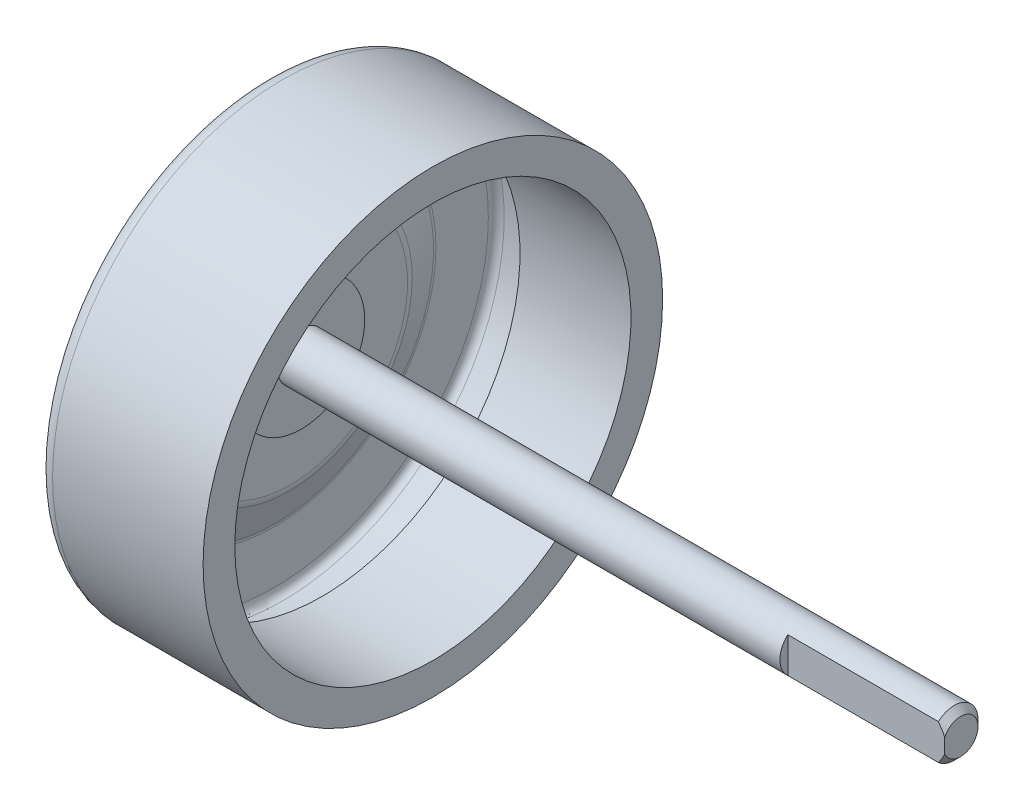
SolidWorks part; units mm, degrees
ref_plane "Plan de face" through (0, 0, 0) normal (0, 0, 1) x (1, 0, 0)
ref_plane "Plan de dessus" through (0, 0, 0) normal (0, 1, 0) x (1, 0, 0)
ref_plane "Plan de droite" through (0, 0, 0) normal (1, 0, 0) x (0, 0, -1)
sketch "Esquisse1" plane through (0, 0, 0) normal (0, 0, 1) x (1, 0, 0)
  line L0 (-6.4357, 0) -> (58.0712, 0) construction
  line L1 (0, 20) -> (0, -20) construction
  line L2 (10.5, 20) -> (10.5, -21.8881) construction
  line L3 (-2.6612, 14.5) -> (14.1549, 14.5) construction
  line L4 (2.2752, 12.5) -> (11.4427, 12.5) construction
  line L5 (3.5, 16.0838) -> (3.5, 10.7677) construction
  line L6 (-0.9253, 14) -> (3.9025, 14) construction
  line L7 (-1.7933, 10) -> (1.7869, 10) construction
  line L8 (0, 7.5) -> (2.2752, 7.5) construction
  line L9 (1, 8.164) -> (1, -0.5696) construction
  line L10 (10.5, 14.5) -> (1, 14.5)
  line L11 (0, 13.5) -> (0, 10.1926)
  line L12 (0.0715, 9.8212) -> (0.9642, 7.5894)
  line L13 (-0.9253, 4) -> (3.9025, 4) construction
  line L14 (0.8, 4.638) -> (0.8, -0.5696) construction
  line L15 (1, 4) -> (1, 7.4037)
  line L16 (1.5, 4) -> (1.5, 7.4037)
  line L17 (0.5358, 10.0069) -> (1.4285, 7.7751)
  line L18 (0.5, 13.5) -> (0.5, 10.1926)
  line L19 (3.5, 14) -> (1, 14)
  line L20 (10.5, 14) -> (0.5, 14) construction
  line L21 (3.5, 14) -> (3.5, 12.5)
  line L22 (3.5, 12.5) -> (10.5, 12.5)
  line L23 (10.5, 12.5) -> (10.5, 14.5)
  line L24 (2.2, 6.1272) -> (2.2, -1.0459) construction
  line L25 (43.8, 7.5) -> (43.8, -11.6094) construction
  line L26 (-1.7933, 1.5) -> (47.2832, 1.5) construction
  line L27 (1.5, 4) -> (2.2, 4)
  line L28 (2.2, 4) -> (2.2, 1.5)
  line L29 (2.2, 1.5) -> (43.8, 1.5)
  line L30 (43.8, 1.5) -> (43.8, 0)
  line L31 (43.8, 0) -> (0.8, 0)
  line L32 (0.8, 0) -> (0.8, 4)
  line L33 (0.8, 4) -> (1, 4)
  line L34 (10.5, 14.5) -> (0, 14.5) construction
  line L35 (0, 14.5) -> (0, 10) construction
  line L36 (0.5, 14) -> (0.5, 10.0963) construction
  line L37 (0, 10) -> (1, 7.5) construction
  line L38 (1, 4) -> (1, 7.5) construction
  line L39 (0.5, 10.0963) -> (1.5, 7.5963) construction
  line L40 (1.5, 4) -> (1.5, 7.5963) construction
  arc A0 (1, 14.5) -> (0, 13.5) centre (1, 13.5) ccw
  arc A1 (0.5, 13.5) -> (1, 14) centre (1, 13.5) cw
  arc A2 (0, 10.1926) -> (0.0715, 9.8212) centre (1, 10.1926) ccw
  arc A3 (0.9642, 7.5894) -> (1, 7.4037) centre (0.5, 7.4037) cw
  arc A4 (0.5358, 10.0069) -> (0.5, 10.1926) centre (1, 10.1926) cw
  arc A5 (1.5, 7.4037) -> (1.4285, 7.7751) centre (0.5, 7.4037) ccw
  point P53 (0, 14.5)
  dimension "D2" = 1
  dimension "D3" = 0.5
  dimension "D4" = 1
  dimension "D5" = 0.5
  dimension "D6" = 1
  dimension "D1" = 0.5
revolve "Révolution2" add sketch "Esquisse1" angle 360 about L0
chamfer "Chanfrein1" distance 0.4 angle 45 1 edges at (43.8, 0, 1.5)
ref_plane " " through (0, 0, 1.5) normal (0, 0, 1) x (1, 0, 0)
sketch "Esquisse2" plane through (0, 0, 1.5) normal (0, 0, 1) x (1, 0, 0)
  line L0 (33.9, 5.4089) -> (33.9, -6.4218) construction
  line L2 (33.9, 2.9374) -> (44.3458, 2.9374)
  line L3 (33.9, 2.9374) -> (33.9, -2.7348)
  line L4 (33.9, -2.7348) -> (44.3458, -2.7348)
  line L5 (44.3458, 2.9374) -> (44.3458, -2.7348)
extrude "Enlèv. mat.-Extru.1" cut sketch "Esquisse2" against normal blind 0.5
sketch "Esquisse3" plane through (2.2, 0, 0) normal (1, 0, 0) x (0, 0, -1)
  text T0 "www.a4.fr" font "Arial" height 0.01
extrude "Enlèv. mat.-Extru.7" cut sketch "Esquisse3" against normal blind 0.001
sketch "Esquisse4" plane through (0, 0, 1) normal (0, 0, 1) x (1, 0, 0)
  text T0 "www.a4.fr" font "Arial" height 0.01
extrude "Enlèv. mat.-Extru.8" cut sketch "Esquisse4" against normal blind 0.001
